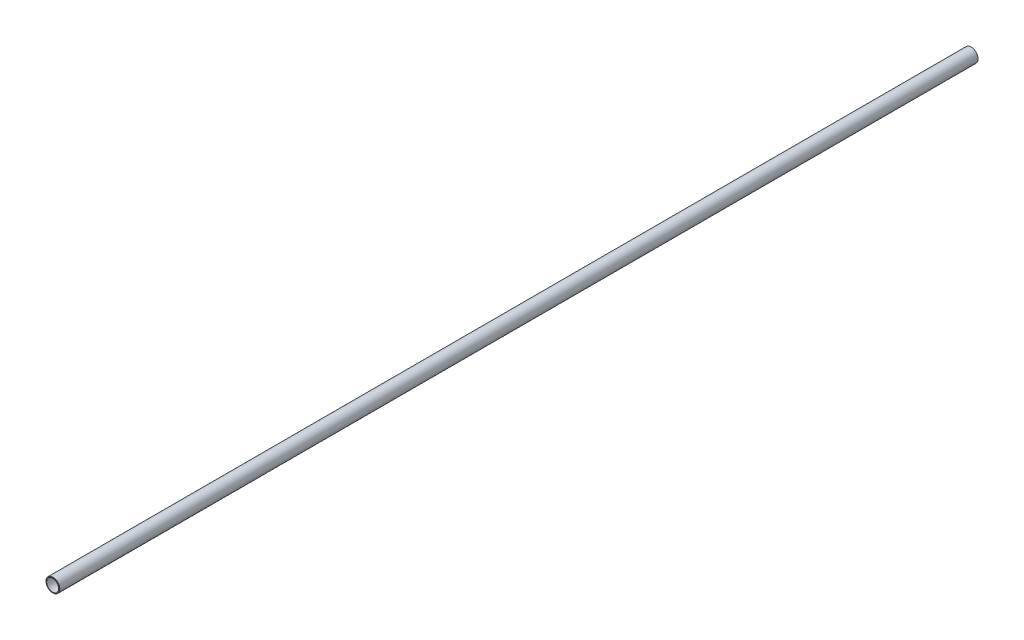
SolidWorks part; units mm, degrees
ref_plane "Plan de face" through (0, 0, 0) normal (0, 0, 1) x (1, 0, 0)
ref_plane "Plan de dessus" through (0, 0, 0) normal (0, 1, 0) x (1, 0, 0)
ref_plane "Plan de droite" through (0, 0, 0) normal (1, 0, 0) x (0, 0, -1)
sketch "Esquisse1" plane through (0, 0, 0) normal (0, 0, 1) x (1, 0, 0)
  circle A0 centre (0, 0) radius 15
  circle A1 centre (0, 0) radius 13
  dimension "D1" = 30
  dimension "D2" = 2
extrude "Boss.-Extru.1" add sketch "Esquisse1" along normal blind 2000
chamfer "Chanfrein1" distance 0.5 angle 45 2 edges at (15, 0, 2000) (15, 0, 0)
